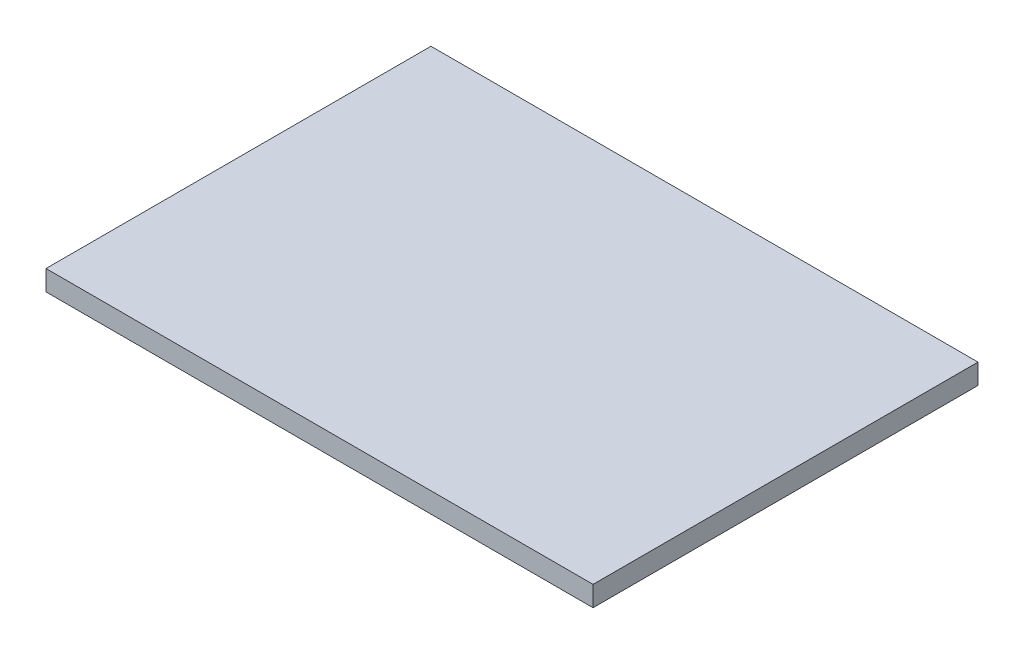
SolidWorks part; units mm, degrees
ref_plane "Front Plane" through (0, 0, 0) normal (0, 0, 1) x (1, 0, 0)
ref_plane "Top Plane" through (0, 0, 0) normal (0, 1, 0) x (1, 0, 0)
ref_plane "Right Plane" through (0, 0, 0) normal (1, 0, 0) x (0, 0, -1)
sketch "Sketch1" plane through (0, 0, 0) normal (0, 1, 0) x (1, 0, 0)
  line L1 (0, 0) -> (171.45, 0)
  line L2 (0, 0) -> (0, 120.65)
  line L3 (0, 120.65) -> (171.45, 120.65)
  line L4 (171.45, 0) -> (171.45, 120.65)
  dimension "D1" = 171.45
  dimension "D2" = 120.65
extrude "Boss-Extrude1" add sketch "Sketch1" along normal blind 6.35
